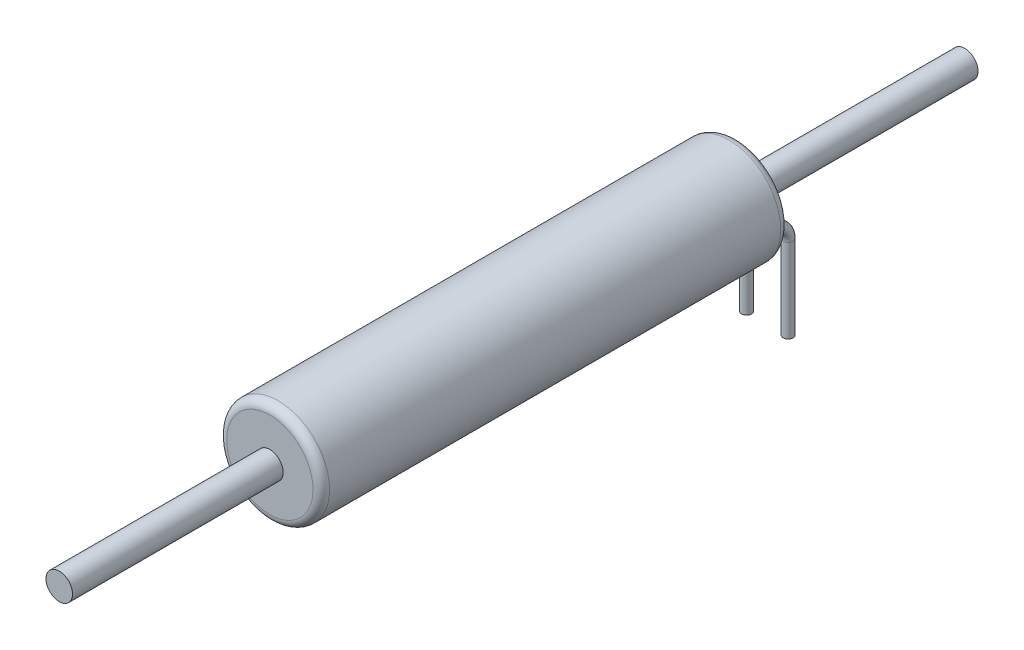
SolidWorks part; units mm, degrees
ref_plane "Front Plane" through (0, 0, 0) normal (0, 0, 1) x (1, 0, 0)
ref_plane "Top Plane" through (0, 0, 0) normal (0, 1, 0) x (1, 0, 0)
ref_plane "Right Plane" through (0, 0, 0) normal (1, 0, 0) x (0, 0, -1)
imported_body "Imported1"
sketch "Sketch1" plane through (0, 0, 54.9) normal (0, 0, 1) x (1, 0, 0)
  circle A0 centre (0, 0) radius 0.8
  dimension "D1" = 1.6
extrude "Cut-Extrude1" cut sketch "Sketch1" against normal blind 14
sketch "Sketch2" plane through (0, 0, -26.7) normal (0, 0, -1) x (-1, 0, 0)
  circle A0 centre (0, 0) radius 0.8
  dimension "D1" = 1.6
extrude "Cut-Extrude2" cut sketch "Sketch2" against normal blind 13
